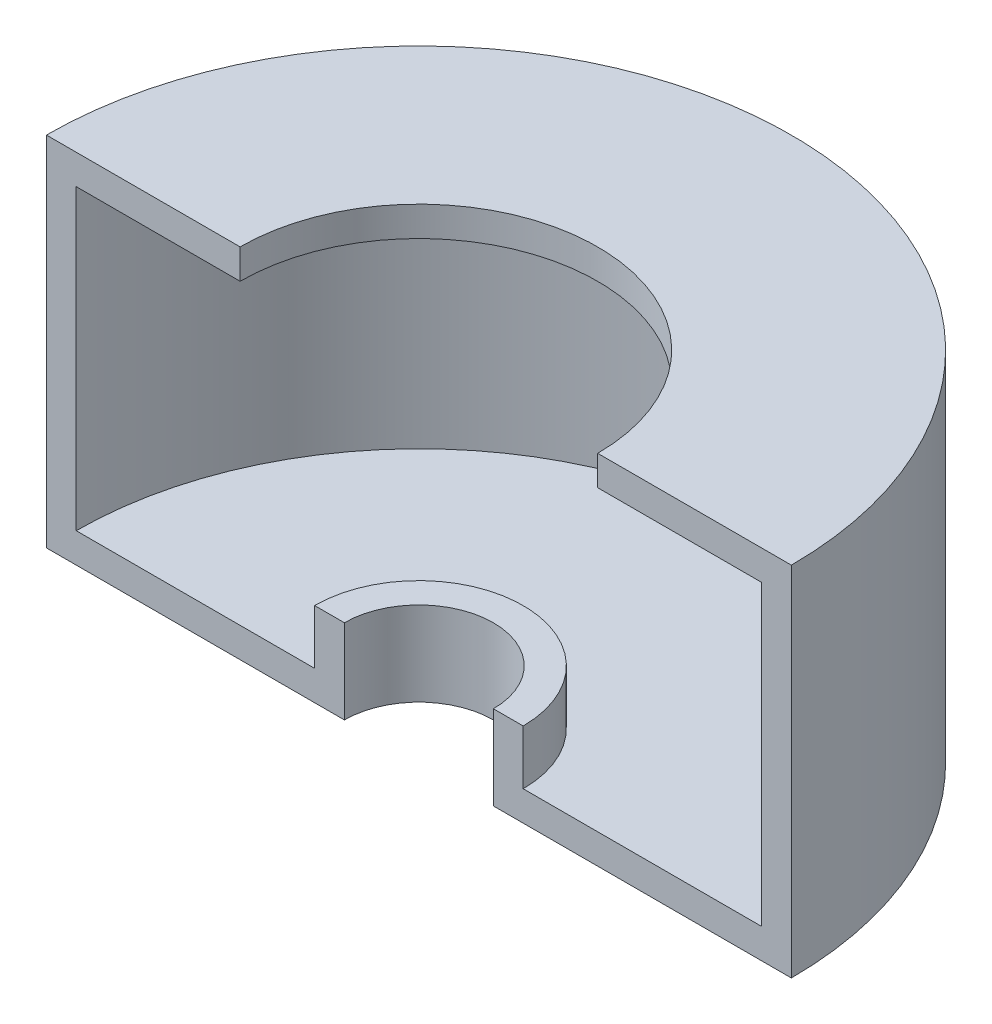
SolidWorks part; units mm, degrees
ref_plane "Plane1" through (0, 0, 0) normal (0, 0, 1) x (1, 0, 0)
ref_plane "Plane2" through (0, 0, 0) normal (0, 1, 0) x (1, 0, 0)
ref_plane "Plane3" through (0, 0, 0) normal (1, 0, 0) x (0, 0, -1)
sketch "Sketch1" plane through (0, 0, 0) normal (0, 0, 1) x (1, 0, 0)
  line L0 (0, 100) -> (0, 20) construction
  line L1 (30, 80.8725) -> (57.5, 80.8725)
  line L2 (17.5, 30.8725) -> (17.5, 40)
  line L3 (17.5, 30.8725) -> (57.5, 30.8725)
  line L4 (57.5, 80.8725) -> (57.5, 30.8725)
revolve "Base-Revolve-Thin" add sketch "Sketch1" angle 180 about L0
